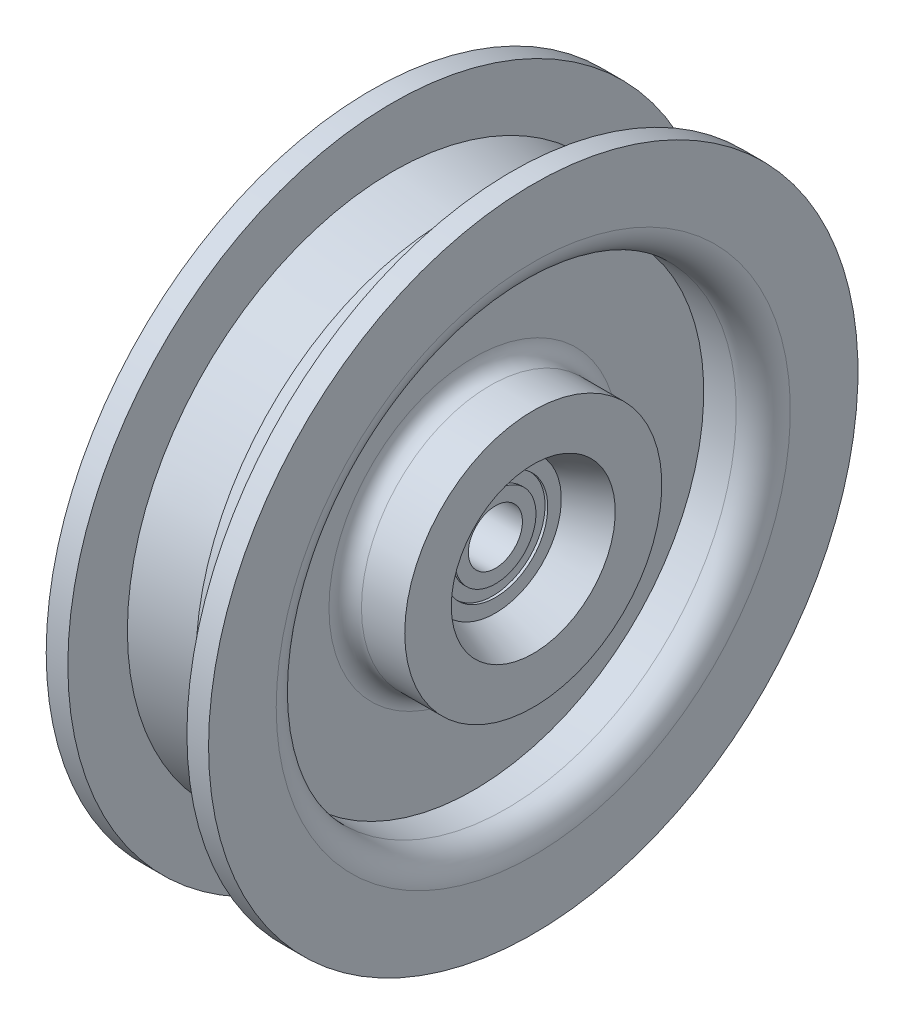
SolidWorks part; units mm, degrees
ref_plane "Plan de face" through (0, 0, 0) normal (0, 0, 1) x (1, 0, 0)
ref_plane "Plan de dessus" through (0, 0, 0) normal (0, 1, 0) x (1, 0, 0)
ref_plane "Plan de droite" through (0, 0, 0) normal (1, 0, 0) x (0, 0, -1)
sketch "Esquisse1" plane through (0, 0, 0) normal (0, 0, 1) x (1, 0, 0)
  line L0 (0, 47.33) -> (11, 49)
  line L2 (11, 49) -> (11, 60)
  line L3 (11, 60) -> (15, 60)
  line L4 (15, 60) -> (15, 47.5)
  line L5 (4, 42.5) -> (4, 26.75)
  line L6 (4, 42.5) -> (10, 42.5)
  line L7 (7, 23.75) -> (15, 23.75)
  line L8 (-8, 12.18) -> (8, 12.18)
  line L9 (8, 12.18) -> (15, 15.15)
  line L10 (15, 23.75) -> (15, 15.15)
  line L12 (0, 0) -> (0, 77.7891) construction
  line L13 (-4, 42.5) -> (-4, 26.75)
  line L14 (-11, 49) -> (32.8464, 49) construction
  line L16 (-15, 23.75) -> (-15, 15.15)
  line L17 (-8, 12.18) -> (-15, 15.15)
  line L18 (-7, 23.75) -> (-15, 23.75)
  line L19 (-4, 42.5) -> (-10, 42.5)
  line L20 (-15, 60) -> (-15, 47.5)
  line L21 (-11, 60) -> (-15, 60)
  line L22 (-11, 49) -> (-11, 60)
  line L23 (0, 47.33) -> (-11, 49)
  line L24 (-8, 12.18) -> (-15, 15.15)
  line L25 (0, 0) -> (22.9308, 0) construction
  arc A0 (15, 47.5) -> (10, 42.5) centre (10, 47.5) cw
  arc A1 (4, 26.75) -> (7, 23.75) centre (7, 26.75) ccw
  arc A2 (-4, 26.75) -> (-7, 23.75) centre (-7, 26.75) cw
  arc A3 (-15, 47.5) -> (-10, 42.5) centre (-10, 47.5) ccw
  point P18 (15, 42.5)
  point P34 (0, 12.18)
  point P36 (-15, 42.5)
  dimension "D12" = 5
  dimension "D13" = 3
  dimension "D1" = 49
  dimension "D2" = 11
  dimension "D3" = 47.33
  dimension "D4" = 60
  dimension "D5" = 17.5
  dimension "D6" = 4
  dimension "D7" = 11
  dimension "D8" = 23.75
  dimension "D9" = 12.18
  dimension "D10" = 8
  dimension "D11" = 15.15
revolve "Révolution1" add sketch "Esquisse1" angle 360 about L25
sketch "Esquisse2" plane through (0, 0, 0) normal (0, 0, 1) x (1, 0, 0)
  line L0 (0, 47.33) -> (0, -47.33) construction
  line L1 (0, 12.18) -> (8, 12.18)
  line L2 (0, 12.18) -> (0, 9.68)
  line L3 (0, 5) -> (8, 5)
  line L4 (8, 12.18) -> (8, 9.68)
  line L5 (8, 12.18) -> (8, -12.18) construction
  line L6 (0, 7.5) -> (0, 5)
  line L7 (0, 9.68) -> (0.5, 9.68)
  line L8 (8, 7.5) -> (8, 5)
  line L9 (0, 7.5) -> (0.5, 7.5)
  line L10 (0.5, 9.68) -> (0.5, 7.5)
  line L11 (8, 9.68) -> (7.5, 9.68)
  line L12 (0, 0) -> (11.9803, 0) construction
  line L13 (8, 7.5) -> (7.5, 7.5)
  line L14 (7.5, 9.68) -> (7.5, 7.5)
  dimension "D1" = 5
  dimension "D2" = 12.18
  dimension "D3" = 2.5
  dimension "D4" = 2.5
  dimension "D5" = 0.5
  dimension "D6" = 0.5
  dimension "D7" = 2.5
  dimension "D8" = 2.5
revolve "Révolution2" add sketch "Esquisse2" angle 360 about L12
mirror "Symétrie1" of "Révolution2"
